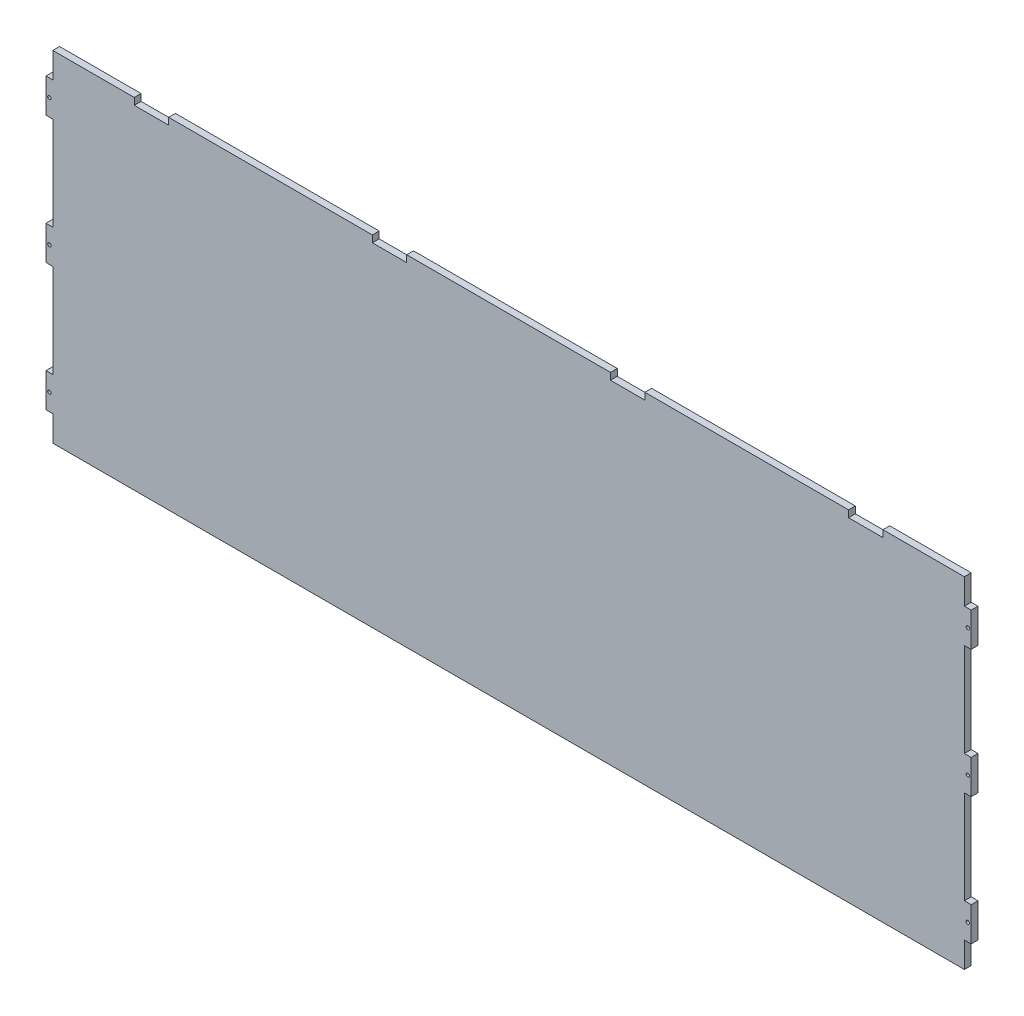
SolidWorks part; units mm, degrees
ref_plane "Ebene vorne" through (0, 0, 0) normal (0, 0, 1) x (1, 0, 0)
ref_plane "Ebene oben" through (0, 0, 0) normal (0, 1, 0) x (1, 0, 0)
ref_plane "Ebene rechts" through (0, 0, 0) normal (1, 0, 0) x (0, 0, -1)
sketch "Skizze1" plane through (0, 0, 0) normal (0, 0, 1) x (1, 0, 0)
  line L1 (-272, -100) -> (272, -100)
  line L2 (-272, -100) -> (-272, 100)
  line L3 (-272, 100) -> (272, 100)
  line L4 (272, -100) -> (272, 100)
  line L5 (-272, -100) -> (272, 100) construction
  line L6 (-272, 100) -> (272, -100) construction
  point P0 (0, 0)
  dimension "D1" = 200
  dimension "D2" = 544
extrude "Aufsatz-Linear austragen1" add sketch "Skizze1" along normal blind 4
sketch "Skizze2" plane through (0, 0, 4) normal (0, 0, 1) x (1, 0, 0)
  line L0 (272, -100) -> (272, 100) construction
  line L1 (272, 100) -> (268, 100)
  line L2 (272, 100) -> (272, 85)
  line L3 (272, 85) -> (268, 85)
  line L4 (268, 100) -> (268, 85)
  line L5 (272, 65) -> (268, 65)
  line L6 (272, 65) -> (272, 10)
  line L7 (272, 10) -> (268, 10)
  line L8 (268, 65) -> (268, 10)
  line L9 (270, 65) -> (270, 85) construction
  line L10 (272, -10) -> (268, -10)
  line L11 (272, -10) -> (272, -65)
  line L12 (272, -65) -> (268, -65)
  line L13 (268, -10) -> (268, -65)
  line L14 (272, -100) -> (268, -100)
  line L15 (272, -100) -> (272, -85)
  line L16 (272, -85) -> (268, -85)
  line L17 (268, -100) -> (268, -85)
  line L18 (270, -10) -> (270, 10) construction
  line L19 (270, -85) -> (270, -65) construction
  line L20 (272, 0) -> (270, 0) construction
  point P28 (270, -75)
  point P29 (270, 75)
  dimension "D1" = 20
  dimension "D2" = 75
  dimension "D3" = 75
  dimension "D4" = 4
extrude "Schnitt-Linear austragen1" cut sketch "Skizze2" against normal through all
mirror "Spiegeln1" about plane through (0, 0, 0) normal (1, 0, 0) of "Schnitt-Linear austragen1"
sketch "Skizze3" plane through (0, 0, 4) normal (0, 0, 1) x (1, 0, 0)
  line L0 (268, 100) -> (-268, 100) construction
  line L1 (-220.1, 100) -> (-199.9, 100)
  line L2 (-220.1, 100) -> (-220.1, 96)
  line L3 (-220.1, 96) -> (-199.9, 96)
  line L4 (-199.9, 100) -> (-199.9, 96)
  line L5 (-59.9, 98) -> (59.9, 98) construction
  line L6 (-80.1, 100) -> (-59.9, 100)
  line L7 (-80.1, 100) -> (-80.1, 96)
  line L8 (-80.1, 96) -> (-59.9, 96)
  line L9 (-59.9, 100) -> (-59.9, 96)
  line L10 (59.9, 100) -> (80.1, 100)
  line L11 (59.9, 100) -> (59.9, 96)
  line L12 (59.9, 96) -> (80.1, 96)
  line L13 (80.1, 100) -> (80.1, 96)
  line L14 (199.9, 100) -> (220.1, 100)
  line L15 (199.9, 100) -> (199.9, 96)
  line L16 (199.9, 96) -> (220.1, 96)
  line L17 (220.1, 100) -> (220.1, 96)
  line L18 (0, 0) -> (0, 98) construction
  point P23 (-70, 100)
  point P24 (-210, 100)
  point P25 (70, 100)
  point P26 (210, 100)
  dimension "D1" = 20.2
  dimension "D2" = 70
  dimension "D3" = 140
  dimension "D4" = 140
  dimension "D5" = 4
extrude "Schnitt-Linear austragen2" cut sketch "Skizze3" against normal through all
hole_wizard "Ø2.0 (2) Durchmesser Bohrung1" positions "Skizze4" profile "Skizze5" hole size "Ø2.0" standard "DIN"
sketch "Skizze4" plane through (0, 0, 4) normal (0, 0, 1) x (1, 0, 0)
  line L0 (-272, 75) -> (-270, 75) construction
  line L1 (-272, 85) -> (-272, 65) construction
  line L2 (-272, 0) -> (-270, 0) construction
  line L3 (-272, 10) -> (-272, -10) construction
  line L5 (-272, -75) -> (-270, -75) construction
  line L6 (-272, -65) -> (-272, -85) construction
  line L8 (272, 65) -> (272, 85) construction
  point P0 (-270, 75)
  point P2 (-270, 0)
  point P4 (-270, -75)
  point P6 (270, 75)
  point P8 (270, 0)
  point P10 (270, -75)
  dimension "D1" = 2
  dimension "D2" = 2
sketch "Skizze5" plane through (-270, 75, 4) normal (1, 0, 0) x (0, -1, 0)
  line L0 (0, 0) -> (0, 4)
  line L1 (0, 4) -> (1, 4)
  line L2 (1, 4) -> (1, 0)
  line L5 (1, 0) -> (0, 0)
  line L11 (0, -6.35) -> (0, 107.95) construction
  dimension "Bohrerdurchmesser" = 2
  dimension "Bohrungstiefe" = 4
